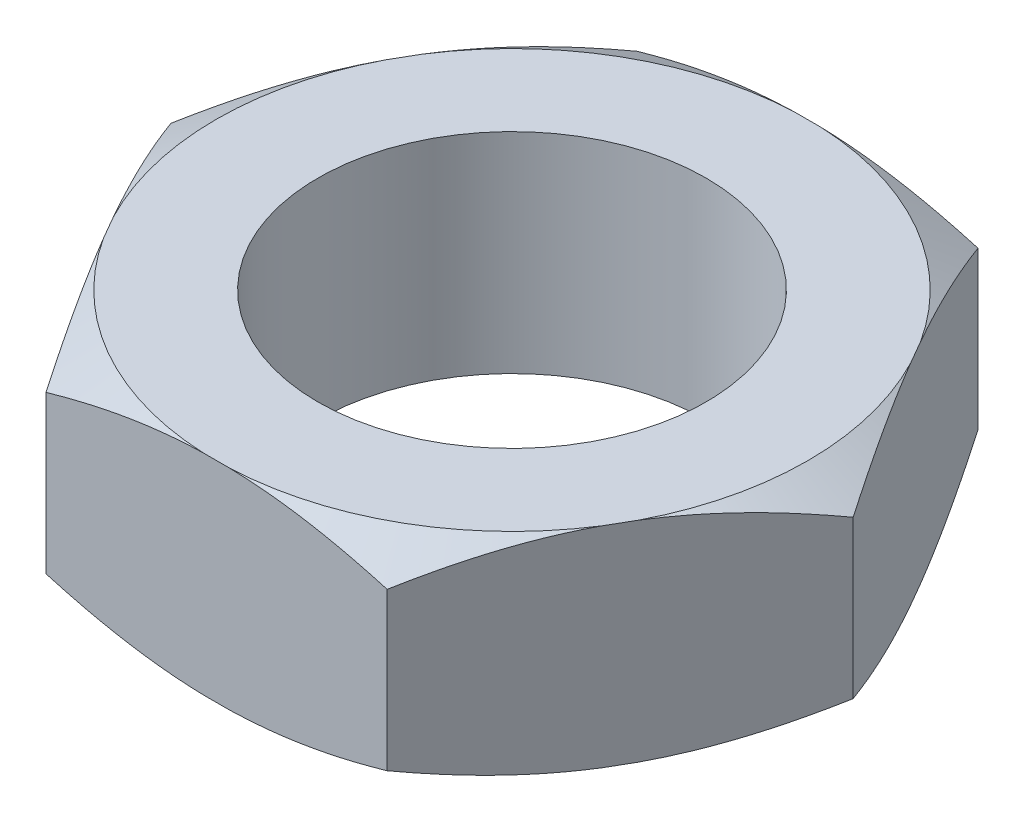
SolidWorks part; units mm, degrees
ref_plane "Front" through (0, 0, 0) normal (0, 0, 1) x (1, 0, 0)
ref_plane "Top" through (0, 0, 0) normal (0, 1, 0) x (1, 0, 0)
ref_plane "Right" through (0, 0, 0) normal (1, 0, 0) x (0, 0, -1)
sketch "Sketch2" plane through (0, 0, 0) normal (0, 1, 0) x (1, 0, 0)
  line L1 (4.395, 0) -> (2.1975, 3.8062)
  line L2 (2.1975, 3.8062) -> (-2.1975, 3.8062)
  line L3 (-2.1975, 3.8062) -> (-4.395, 0)
  line L4 (-4.395, 0) -> (-2.1975, -3.8062)
  line L5 (-2.1975, -3.8062) -> (2.1975, -3.8062)
  line L6 (2.1975, -3.8062) -> (4.395, 0)
  circle A0 centre (0, 0) radius 4.395 construction
extrude "Extrude1" add sketch "Sketch2" along normal blind 2.7
sketch "Sketch3" plane through (0, 2.7, 0) normal (0, 1, 0) x (-1, 0, 0)
  circle A0 centre (0, 0) radius 2.5
extrude "Cut-Extrude1" cut sketch "Sketch3" against normal blind 3.5
sketch "Sketch6" plane through (0, 0, 0) normal (0, 0, 1) x (1, 0, 0)
  line L0 (0, 0) -> (0, 5.0587)
  line L1 (6.7471, 2.7) -> (6.7471, 0)
  line L2 (3.81, 2.7) -> (5.5613, 1.6889)
  line L4 (3.81, 0) -> (5.6321, 1.052)
  line L5 (3.81, 2.7) -> (6.7471, 2.7)
  line L7 (5.5613, 1.6889) -> (5.6321, 1.052)
  line L8 (6.7471, 0) -> (3.81, 0)
  dimension "D1" = 2.7
  dimension "D2" = 3.81
revolve "Cut-Revolve1" cut sketch "Sketch6" angle 360 about L0
